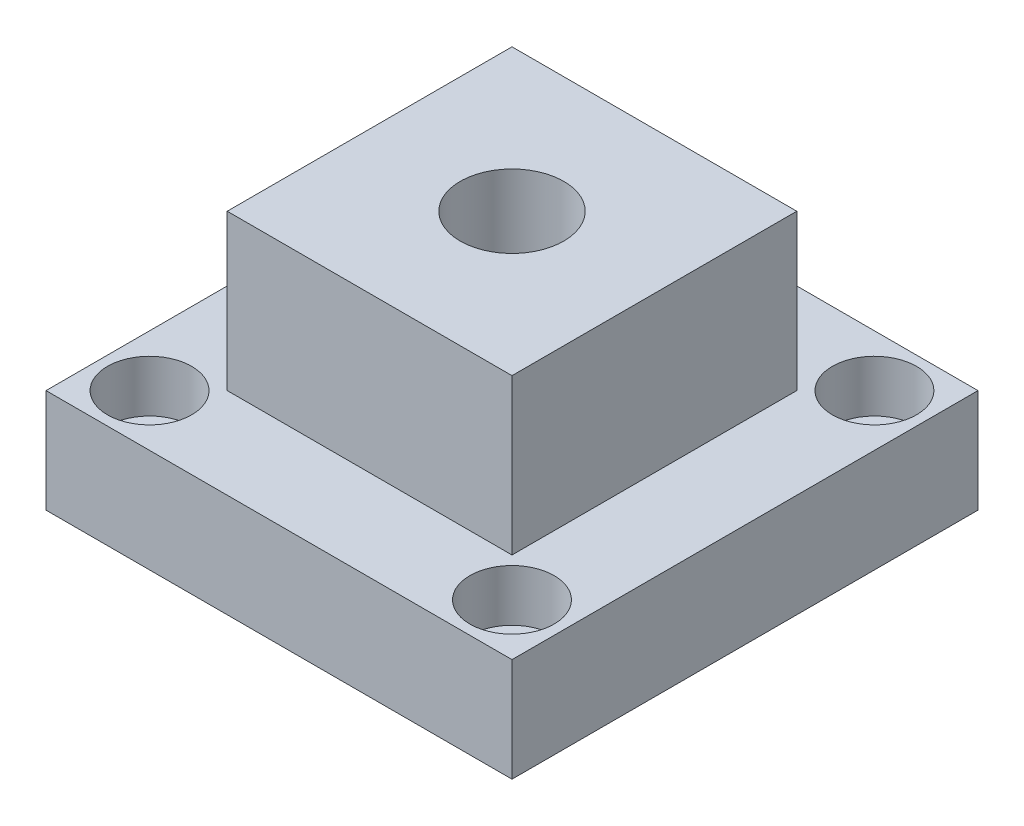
SolidWorks part; units mm, degrees
ref_plane "Front" through (0, 0, 0) normal (0, 0, 1) x (1, 0, 0)
ref_plane "Top" through (0, 0, 0) normal (0, 1, 0) x (1, 0, 0)
ref_plane "Right" through (0, 0, 0) normal (1, 0, 0) x (0, 0, -1)
sketch "Sketch1" plane through (0, 0, 0) normal (0, 1, 0) x (1, 0, 0)
  line L1 (0, 0) -> (114.3, 0)
  line L2 (0, 0) -> (0, 114.3)
  line L3 (0, 114.3) -> (114.3, 114.3)
  line L4 (114.3, 0) -> (114.3, 114.3)
  dimension "D1" = 114.3
  dimension "D2" = 114.3
extrude "Extrude1" add sketch "Sketch1" along normal blind 25.4
sketch "Sketch2" plane through (0, 25.4, 0) normal (0, -1, 0) x (1, 0, 0)
  line L0 (0, -114.3) -> (0, 0) construction
  line L1 (0, 0) -> (114.3, 0) construction
  line L2 (114.3, -114.3) -> (0, -114.3) construction
  line L3 (114.3, 0) -> (114.3, -114.3) construction
  point P0 (12.7, -12.7)
  point P1 (101.6, -12.7)
  point P2 (101.6, -101.6)
  point P3 (12.7, -101.6)
  dimension "D1" = 12.7
  dimension "D2" = 12.7
  dimension "D3" = 12.7
  dimension "D4" = 12.7
hole_wizard "CBORE for 1/2 Socket Head Cap Screw1" positions "3DSketch1" profile "Sketch3" counterbore size "1/2" standard "Ansi Inch"
sketch3d "3DSketch1"
  point P0 (12.7, 25.4, -12.7)
  point P3 (101.6, 25.4, -12.7)
  point P6 (12.7, 25.4, -101.6)
  point P9 (101.6, 25.4, -101.6)
sketch "Sketch3" plane through (12.7, 25.4, -12.7) normal (1, 0, 0) x (0, 0, 1)
  line L0 (0, 0) -> (0, 25.4)
  line L1 (6.9456, 24.765) -> (7.5806, 25.4)
  line L2 (6.9456, 24.765) -> (6.9456, 12.7)
  line L3 (6.9456, 12.7) -> (10.3187, 12.7)
  line L4 (10.3187, 12.7) -> (10.3187, 0)
  line L5 (10.3187, 0) -> (0, 0)
  line L11 (0, -6.35) -> (0, 107.95) construction
  line L12 (7.5806, 25.4) -> (0, 25.4)
  line L13 (-6.9456, 24.765) -> (-7.5806, 25.4) construction
  dimension "Thru Hole Dia." = 13.8913
  dimension "Thru Hole Depth" = 25.4
  dimension "C'Bore Dia." = 20.6375
  dimension "C'Bore Depth" = 12.7
  dimension "Far C'Sink Dia." = 15.1613
  dimension "Far C'Sink Angle" = 90
sketch "Sketch4" plane through (0, 25.4, 0) normal (0, 1, 0) x (1, 0, 0)
  line L0 (57.15, 92.075) -> (57.15, 114.3) construction
  line L1 (22.225, 22.225) -> (92.075, 22.225)
  line L2 (22.225, 22.225) -> (22.225, 92.075)
  line L3 (22.225, 92.075) -> (92.075, 92.075)
  line L4 (92.075, 22.225) -> (92.075, 92.075)
  line L5 (114.3, 114.3) -> (0, 114.3) construction
  line L6 (22.225, 57.15) -> (0, 57.15) construction
  line L7 (0, 114.3) -> (0, 0) construction
  dimension "D1" = 69.85
  dimension "D2" = 69.85
extrude "Extrude2" add sketch "Sketch4" along normal blind 38.1
sketch "Sketch5" plane through (0, 63.5, 0) normal (0, 1, 0) x (1, 0, 0)
  line L0 (92.075, 22.225) -> (22.225, 92.075) construction
  point P0 (57.15, 57.15)
  point P5 (57.15, 57.15)
hole_wizard "1-12 Tapped Hole1" positions "3DSketch2" profile "Sketch6" tap size "1-12" standard "Ansi Inch"
sketch3d "3DSketch2"
  point P0 (57.15, 63.5, -57.15)
sketch "Sketch6" plane through (57.15, 63.5, -57.15) normal (1, 0, 0) x (0, 0, 1)
  line L0 (0, 0) -> (0, 38.7824)
  line L1 (0, 38.7824) -> (11.7081, 31.7475)
  line L2 (11.7081, 31.7475) -> (11.7081, 25.4)
  line L3 (11.7081, 25.4) -> (12.7, 25.4)
  line L4 (12.7, 25.4) -> (12.7, 0)
  line L5 (12.7, 0) -> (0, 0)
  line L10 (0, 38.7824) -> (-11.7081, 31.7475) construction
  line L11 (0, -6.35) -> (0, 107.95) construction
  dimension "Tap Drill Dia." = 23.4163
  dimension "Tap Drill Depth" = 31.7475
  dimension "Thread Major Dia." = 25.4
  dimension "Thread Depth" = 25.4
  dimension "Drill Angle" = 118
